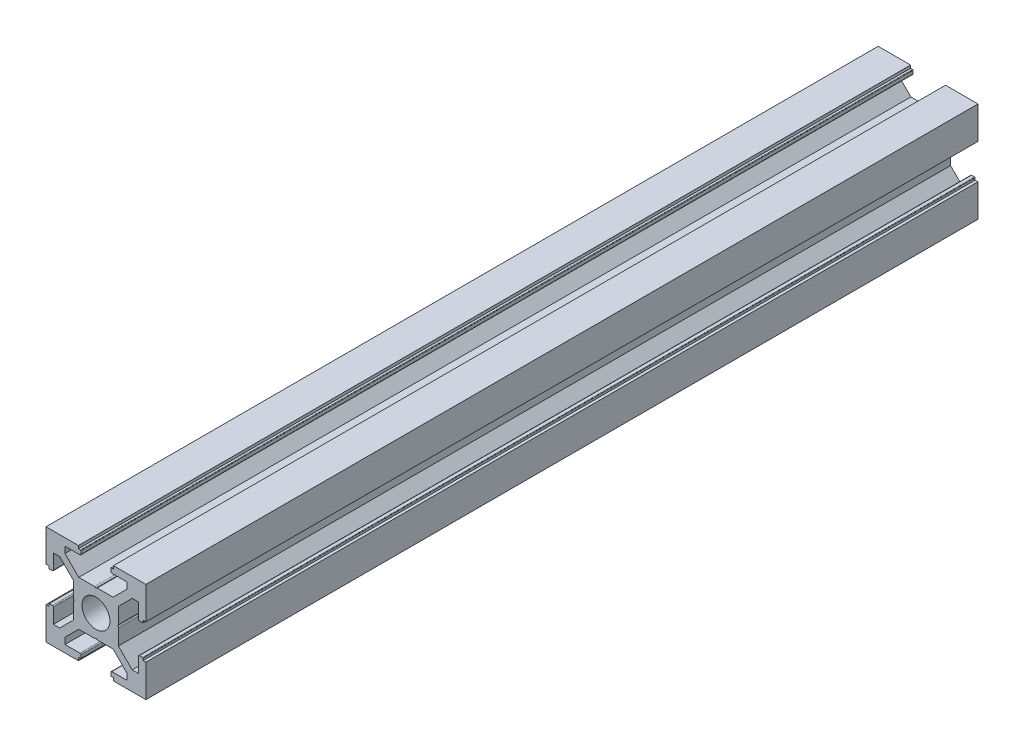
SolidWorks part; units mm, degrees
ref_plane "Alzado" through (0, 0, 0) normal (0, 0, 1) x (1, 0, 0)
ref_plane "Planta" through (0, 0, 0) normal (0, 1, 0) x (1, 0, 0)
ref_plane "Vista lateral" through (0, 0, 0) normal (1, 0, 0) x (0, 0, -1)
sketch "Croquis1" plane through (0, 0, 0) normal (0, 0, 1) x (1, 0, 0)
  line L0 (-15, 15) -> (-5.25, 15)
  line L1 (6.7045, 8.2955) -> (5.159, 6.75)
  line L8 (15, 15) -> (5.25, 15)
  line L10 (-5.25, 12.795) -> (-4.5, 12.795) construction
  line L11 (-4.5, 12.795) -> (-4.5, 14.145) construction
  line L12 (-4.65, 14.145) -> (-5.25, 14.145)
  line L13 (-5.25, 14.145) -> (-5.25, 15)
  line L15 (-9.3, 12.795) -> (-4.8, 12.795)
  line L16 (-4.5, 13.095) -> (-4.5, 13.995)
  line L20 (-9.3, 12.795) -> (-9.3, 10.891)
  line L21 (-9.3, 10.891) -> (-6.7045, 8.2955)
  line L22 (-6.7045, 8.2955) -> (-5.159, 6.75)
  line L23 (-8.2955, 6.7045) -> (-6.75, 5.159)
  line L24 (-10.891, 9.3) -> (-8.2955, 6.7045)
  line L25 (-12.795, 9.3) -> (-10.891, 9.3)
  line L26 (-12.795, 9.3) -> (-12.795, 4.8)
  line L27 (-13.095, 4.5) -> (-13.995, 4.5)
  line L28 (-14.145, 4.65) -> (-14.145, 5.25)
  line L29 (-14.145, 5.25) -> (-15, 5.25)
  line L30 (-15, 15) -> (-15, 5.25)
  line L31 (-15, -15) -> (-15, -5.25)
  line L32 (-14.145, -5.25) -> (-15, -5.25)
  line L33 (-14.145, -4.65) -> (-14.145, -5.25)
  line L34 (-13.095, -4.5) -> (-13.995, -4.5)
  line L35 (-12.795, -9.3) -> (-12.795, -4.8)
  line L36 (-12.795, -9.3) -> (-10.891, -9.3)
  line L37 (-10.891, -9.3) -> (-8.2955, -6.7045)
  line L38 (-8.2955, -6.7045) -> (-6.75, -5.159)
  line L39 (-6.7045, -8.2955) -> (-5.159, -6.75)
  line L40 (-9.3, -10.891) -> (-6.7045, -8.2955)
  line L41 (-9.3, -12.795) -> (-9.3, -10.891)
  line L42 (-9.3, -12.795) -> (-4.8, -12.795)
  line L43 (-4.5, -13.095) -> (-4.5, -13.995)
  line L44 (-4.65, -14.145) -> (-5.25, -14.145)
  line L45 (-5.25, -14.145) -> (-5.25, -15)
  line L46 (-15, -15) -> (-5.25, -15)
  line L47 (6.7045, -8.2955) -> (5.159, -6.75)
  line L51 (4.5, 12.795) -> (4.5, 14.145) construction
  line L52 (5.25, 12.795) -> (4.5, 12.795) construction
  line L55 (15, -15) -> (5.25, -15)
  line L56 (5.25, -14.145) -> (5.25, -15)
  line L57 (4.65, -14.145) -> (5.25, -14.145)
  line L58 (4.5, -13.095) -> (4.5, -13.995)
  line L59 (9.3, -12.795) -> (4.8, -12.795)
  line L60 (9.3, -12.795) -> (9.3, -10.891)
  line L61 (9.3, -10.891) -> (6.7045, -8.2955)
  line L62 (8.2955, -6.7045) -> (6.75, -5.159)
  line L63 (10.891, -9.3) -> (8.2955, -6.7045)
  line L64 (12.795, -9.3) -> (10.891, -9.3)
  line L65 (12.795, -9.3) -> (12.795, -4.8)
  line L66 (13.095, -4.5) -> (13.995, -4.5)
  line L67 (14.145, -4.65) -> (14.145, -5.25)
  line L68 (14.145, -5.25) -> (15, -5.25)
  line L69 (15, -15) -> (15, -5.25)
  line L70 (15, 15) -> (15, 5.25)
  line L71 (14.145, 5.25) -> (15, 5.25)
  line L72 (14.145, 4.65) -> (14.145, 5.25)
  line L73 (13.095, 4.5) -> (13.995, 4.5)
  line L74 (12.795, 9.3) -> (12.795, 4.8)
  line L75 (12.795, 9.3) -> (10.891, 9.3)
  line L76 (10.891, 9.3) -> (8.2955, 6.7045)
  line L77 (8.2955, 6.7045) -> (6.75, 5.159)
  line L78 (9.3, 10.891) -> (6.7045, 8.2955)
  line L79 (9.3, 12.795) -> (9.3, 10.891)
  line L80 (4.5, 13.095) -> (4.5, 13.995)
  line L81 (9.3, 12.795) -> (4.8, 12.795)
  line L82 (5.25, 14.145) -> (5.25, 15)
  line L83 (4.65, 14.145) -> (5.25, 14.145)
  line L84 (15, 15) -> (5.25, 15)
  line L87 (6.75, 0.45) -> (6.75, 5.159)
  line L88 (6.75, -0.45) -> (6.75, -5.159)
  line L89 (6.3, 0) -> (6.75, 0) construction
  line L90 (-6.75, -0.45) -> (-6.75, -5.159)
  line L91 (-6.75, 0.45) -> (-6.75, 5.159)
  line L94 (5.159, 6.75) -> (0.45, 6.75)
  line L95 (-5.159, 6.75) -> (-0.45, 6.75)
  line L96 (5.159, -6.75) -> (0.45, -6.75)
  line L97 (-5.159, -6.75) -> (-0.45, -6.75)
  arc A0 (-4.5, 13.995) -> (-4.65, 14.145) centre (-4.65, 13.995) ccw
  arc A1 (-4.8, 12.795) -> (-4.5, 13.095) centre (-4.8, 13.095) ccw
  arc A2 (-12.795, 4.8) -> (-13.095, 4.5) centre (-13.095, 4.8) cw
  arc A3 (-13.995, 4.5) -> (-14.145, 4.65) centre (-13.995, 4.65) cw
  arc A4 (-13.995, -4.5) -> (-14.145, -4.65) centre (-13.995, -4.65) ccw
  arc A5 (-12.795, -4.8) -> (-13.095, -4.5) centre (-13.095, -4.8) ccw
  arc A6 (-4.8, -12.795) -> (-4.5, -13.095) centre (-4.8, -13.095) cw
  arc A7 (-4.5, -13.995) -> (-4.65, -14.145) centre (-4.65, -13.995) cw
  arc A8 (4.5, -13.995) -> (4.65, -14.145) centre (4.65, -13.995) ccw
  arc A9 (4.8, -12.795) -> (4.5, -13.095) centre (4.8, -13.095) ccw
  arc A10 (12.795, -4.8) -> (13.095, -4.5) centre (13.095, -4.8) cw
  arc A11 (13.995, -4.5) -> (14.145, -4.65) centre (13.995, -4.65) cw
  arc A12 (13.995, 4.5) -> (14.145, 4.65) centre (13.995, 4.65) ccw
  arc A13 (12.795, 4.8) -> (13.095, 4.5) centre (13.095, 4.8) ccw
  arc A14 (4.8, 12.795) -> (4.5, 13.095) centre (4.8, 13.095) cw
  arc A15 (4.5, 13.995) -> (4.65, 14.145) centre (4.65, 13.995) cw
  circle A16 centre (0, 0) radius 4.2
  arc A17 (6.75, 0.45) -> (6.3, 0) centre (6.3, 0.45) cw
  arc A18 (6.75, -0.45) -> (6.3, 0) centre (6.3, -0.45) ccw
  arc A19 (-6.75, -0.45) -> (-6.3, 0) centre (-6.3, -0.45) cw
  arc A20 (-6.75, 0.45) -> (-6.3, 0) centre (-6.3, 0.45) ccw
  arc A21 (-0.45, 6.75) -> (0, 6.3) centre (-0.45, 6.3) cw
  arc A22 (0.45, 6.75) -> (0, 6.3) centre (0.45, 6.3) ccw
  arc A23 (-0.45, -6.75) -> (0, -6.3) centre (-0.45, -6.3) ccw
  arc A24 (0.45, -6.75) -> (0, -6.3) centre (0.45, -6.3) cw
  point P4 (15, 0)
  point P5 (0, 15)
extrude "Extruir1" add sketch "Croquis1" along normal blind 250
